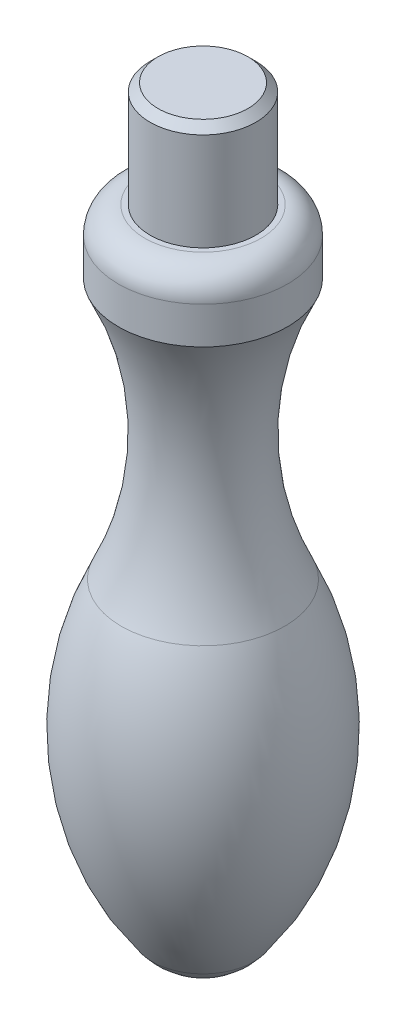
SolidWorks part; units mm, degrees
ref_plane "Front" through (0, 0, 0) normal (0, 0, 1) x (1, 0, 0)
ref_plane "Top" through (0, 0, 0) normal (0, 1, 0) x (1, 0, 0)
ref_plane "Right" through (0, 0, 0) normal (1, 0, 0) x (0, 0, -1)
sketch "Sketch1" plane through (0, 0, 0) normal (0, 0, 1) x (1, 0, 0)
  line L0 (0, 0) -> (0, -114.7653) construction
  line L1 (0, 0) -> (5, 0)
  line L2 (5, 0) -> (5, -10)
  line L3 (5, -10) -> (5.5, -10)
  line L4 (8, -12.5) -> (8, -16)
  line L5 (0, -72) -> (-12.293, -72) construction
  line L6 (0, -72) -> (0, 0)
  arc A0 (8, -12.5) -> (5.5, -10) centre (5.5, -12.5) ccw
  arc A1 (8, -16) -> (7.7289, -40.6665) centre (33, -28.6095) ccw
  arc A2 (7.7289, -40.6665) -> (4.7843, -69.6209) centre (-17.5423, -52.7234) cw
  arc A3 (4.7843, -69.6209) -> (0, -72) centre (0, -66) cw
  dimension "D1" = 6
  dimension "D2" = 28
  dimension "D3" = 10
  dimension "D6" = 28
  dimension "D10" = 2.5
  dimension "D4" = 6
  dimension "D5" = 10
  dimension "D7" = 72
  dimension "D8" = 10
  dimension "D9" = 16
revolve "Revolve1" add sketch "Sketch1" angle 360 about L0
chamfer "Chamfer1" distance 0.75 angle 45
